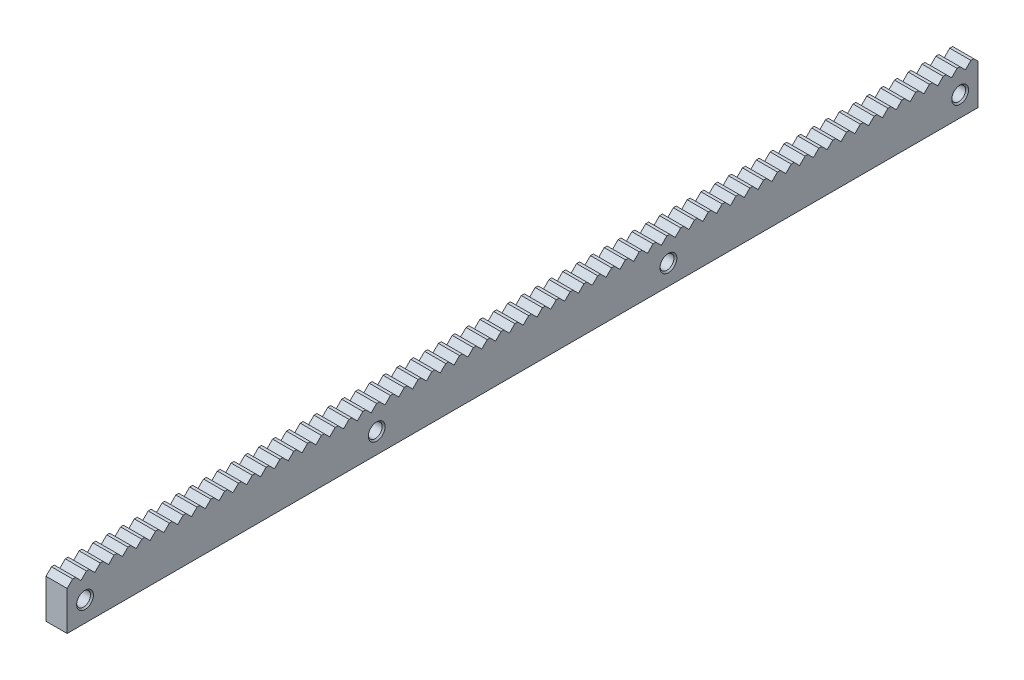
SolidWorks part; units mm, degrees
ref_plane "Front Plane" through (0, 0, 0) normal (0, 0, 1) x (1, 0, 0)
ref_plane "Top Plane" through (0, 0, 0) normal (0, 1, 0) x (1, 0, 0)
ref_plane "Right Plane" through (0, 0, 0) normal (1, 0, 0) x (0, 0, -1)
sketch "Sketch1" plane through (0, 0, 0) normal (1, 0, 0) x (0, 0, -1)
  line L1 (124.9, -6.1) -> (-124.9, -6.1)
  line L2 (124.9, -6.1) -> (124.9, 6.1)
  line L3 (124.9, 6.1) -> (-124.9, 6.1)
  line L4 (-124.9, -6.1) -> (-124.9, 6.1)
  line L5 (124.9, -6.1) -> (-124.9, 6.1) construction
  line L6 (124.9, 6.1) -> (-124.9, -6.1) construction
  point P0 (0, 0)
  dimension "D1" = 249.8
  dimension "D2" = 12.2
extrude "Boss-Extrude1" add sketch "Sketch1" along normal mid plane 5.8
sketch "Sketch2" plane through (0, 0, 0) normal (1, 0, 0) x (0, 0, -1)
  line L0 (-124.9, 4.6) -> (-126.4, 6.1)
  line L1 (-124.9, 6.1) -> (-124.9, -6.1) construction
  line L2 (-126.4, 6.1) -> (-123.4, 6.1)
  line L3 (124.9, 6.1) -> (-124.9, 6.1) construction
  line L4 (-123.4, 6.1) -> (-124.9, 4.6)
  line L5 (-124.9, -6.1) -> (124.9, -6.1) construction
  point P8 (-124.9, 4.6)
  dimension "D1" = 10.7
extrude "Cut-Extrude1" cut sketch "Sketch2" against normal mid plane 5.8
pattern_linear "LPattern1" count 67 spacing 3.79 along (0, -0.7071, -0.7071) of "Cut-Extrude1"
sketch "Sketch3" plane through (0, 0, 0) normal (1, 0, 0) x (0, 0, -1)
  line L0 (-124.9, -6.1) -> (124.9, -6.1) construction
  line L1 (-124.9, 4.6) -> (-124.9, -6.1) construction
  circle A0 centre (-120, -0.56) radius 1.9
  dimension "D3" = 3.8
  dimension "D1" = 5.54
  dimension "D2" = 4.9
extrude "Cut-Extrude2" cut sketch "Sketch3" against normal mid plane 5.8
chamfer "Chamfer1" distance 0.4 angle 45 2 edges at (-2.9, -0.56, 118.1) (2.9, -0.56, 118.1)
pattern_linear "LPattern2" count 4 spacing 80 along (0, 0, -1) of "Cut-Extrude2", "Chamfer1"
